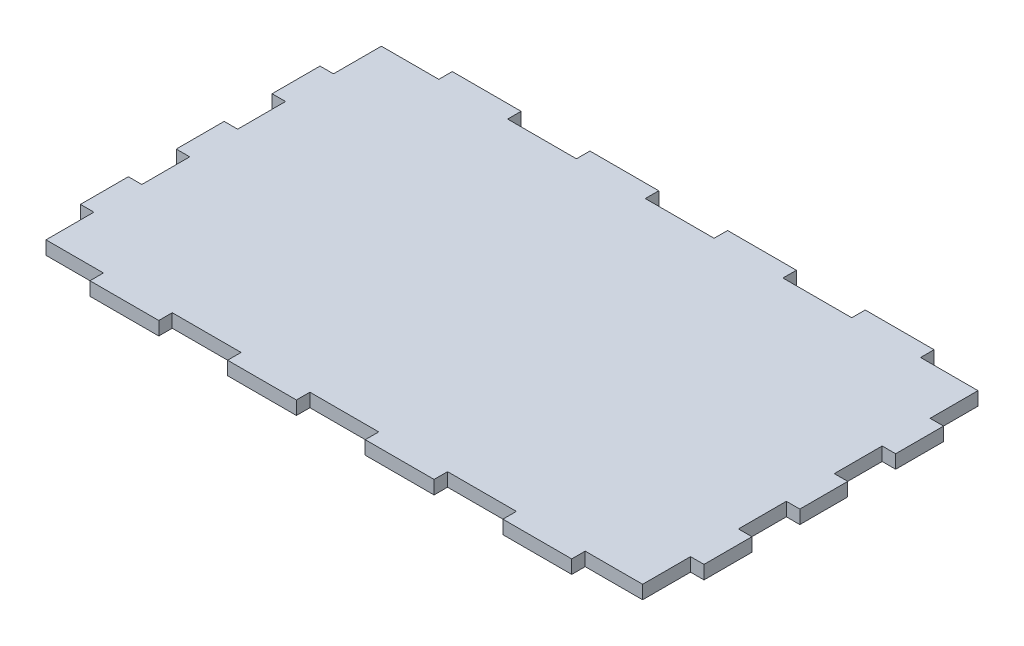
SolidWorks part; units mm, degrees
ref_plane "Front Plane" through (0, 0, 0) normal (0, 0, 1) x (1, 0, 0)
ref_plane "Top Plane" through (0, 0, 0) normal (0, 1, 0) x (1, 0, 0)
ref_plane "Right Plane" through (0, 0, 0) normal (1, 0, 0) x (0, 0, -1)
sketch "Sketch2" plane through (0, 0, 0) normal (0, 1, 0) x (1, 0, 0)
  line L0 (6.24, -32.004) -> (6.24, 0)
  line L1 (413.766, -32.004) -> (413.766, -64.008)
  line L2 (90.568, 0) -> (136.542, 0)
  line L3 (-2.76, -32.004) -> (-2.76, -64.008)
  line L4 (413.766, -32.004) -> (404.766, -32.004)
  line L5 (404.766, -64.008) -> (404.766, -96.012)
  line L6 (404.766, -64.008) -> (413.766, -64.008)
  line L7 (413.766, -96.012) -> (413.766, -128.016)
  line L8 (413.766, -96.012) -> (404.766, -96.012)
  line L10 (404.766, -128.016) -> (413.766, -128.016)
  line L12 (413.766, -160.02) -> (404.766, -160.02)
  line L14 (404.766, -192.024) -> (413.766, -192.024)
  line L16 (404.766, -32.004) -> (404.766, 0)
  line L17 (404.766, -192.024) -> (404.766, -224.028)
  line L18 (404.766, -128.016) -> (404.766, -160.02)
  line L19 (413.766, -160.02) -> (413.766, -192.024)
  line L28 (-2.76, -32.004) -> (6.24, -32.004)
  line L29 (6.24, -64.008) -> (6.24, -96.012)
  line L30 (6.24, -64.008) -> (-2.76, -64.008)
  line L31 (-2.76, -96.012) -> (-2.76, -128.016)
  line L32 (-2.76, -96.012) -> (6.24, -96.012)
  line L33 (6.24, -128.016) -> (6.24, -160.02)
  line L34 (6.24, -128.016) -> (-2.76, -128.016)
  line L35 (-2.76, -160.02) -> (-2.76, -192.024)
  line L36 (-2.76, -160.02) -> (6.24, -160.02)
  line L37 (6.24, -192.024) -> (6.24, -224.028)
  line L38 (6.24, -192.024) -> (-2.76, -192.024)
  line L39 (6.24, 0) -> (44.594, 0)
  line L40 (366.412, 0) -> (404.766, 0)
  line L41 (-2.76, -64.008) -> (-2.4337, -63.4968)
  line L42 (6.24, -224.028) -> (44.594, -224.028)
  line L43 (44.594, 0) -> (44.594, 9)
  line L44 (44.594, 9) -> (90.568, 9)
  line L45 (90.568, 9) -> (90.568, 0)
  line L47 (136.542, 0) -> (136.542, 9)
  line L48 (136.542, 9) -> (182.516, 9)
  line L49 (182.516, 9) -> (182.516, 0)
  line L50 (182.516, 0) -> (228.49, 0)
  line L51 (228.49, 0) -> (228.49, 9)
  line L52 (228.49, 9) -> (274.464, 9)
  line L53 (274.464, 9) -> (274.464, 0)
  line L54 (274.464, 0) -> (320.438, 0)
  line L55 (320.438, 0) -> (320.438, 9)
  line L56 (320.438, 9) -> (366.412, 9)
  line L57 (366.412, 9) -> (366.412, 0)
  line L58 (44.594, -224.028) -> (44.594, -233.028)
  line L59 (44.594, -233.028) -> (90.568, -233.028)
  line L60 (90.568, -233.028) -> (90.568, -224.028)
  line L61 (90.568, -224.028) -> (136.542, -224.028)
  line L62 (136.542, -224.028) -> (136.542, -233.028)
  line L63 (136.542, -233.028) -> (182.516, -233.028)
  line L64 (182.516, -233.028) -> (182.516, -224.028)
  line L65 (182.516, -224.028) -> (228.49, -224.028)
  line L66 (228.49, -224.028) -> (228.49, -233.028)
  line L67 (228.49, -233.028) -> (274.464, -233.028)
  line L68 (274.464, -233.028) -> (274.464, -224.028)
  line L69 (274.464, -224.028) -> (320.438, -224.028)
  line L70 (320.438, -224.028) -> (320.438, -233.028)
  line L71 (320.438, -233.028) -> (366.412, -233.028)
  line L72 (366.412, -233.028) -> (366.412, -224.028)
  line L73 (366.412, -224.028) -> (404.766, -224.028)
  dimension "D1" = 9
  dimension "D2" = 9
  dimension "D3" = 9
  dimension "D4" = 9
  dimension "D5" = 9
  dimension "D6" = 9
  dimension "D7" = 9
  dimension "D8" = 9
  dimension "D9" = 9
  dimension "D10" = 9
  dimension "D11" = 9
  dimension "D12" = 9
  dimension "D13" = 9
  dimension "D14" = 9
  dimension "D15" = 9
  dimension "D16" = 9
  dimension "D17" = 9
  dimension "D18" = 9
  dimension "D19" = 9
  dimension "D20" = 9
  dimension "D21" = 9
  dimension "D22" = 9
  dimension "D23" = 9
  dimension "D24" = 9
  dimension "D25" = 9
  dimension "D26" = 9
  dimension "D27" = 9
  dimension "D28" = 9
extrude "Boss-Extrude2" add sketch "Sketch2" along normal blind 9
